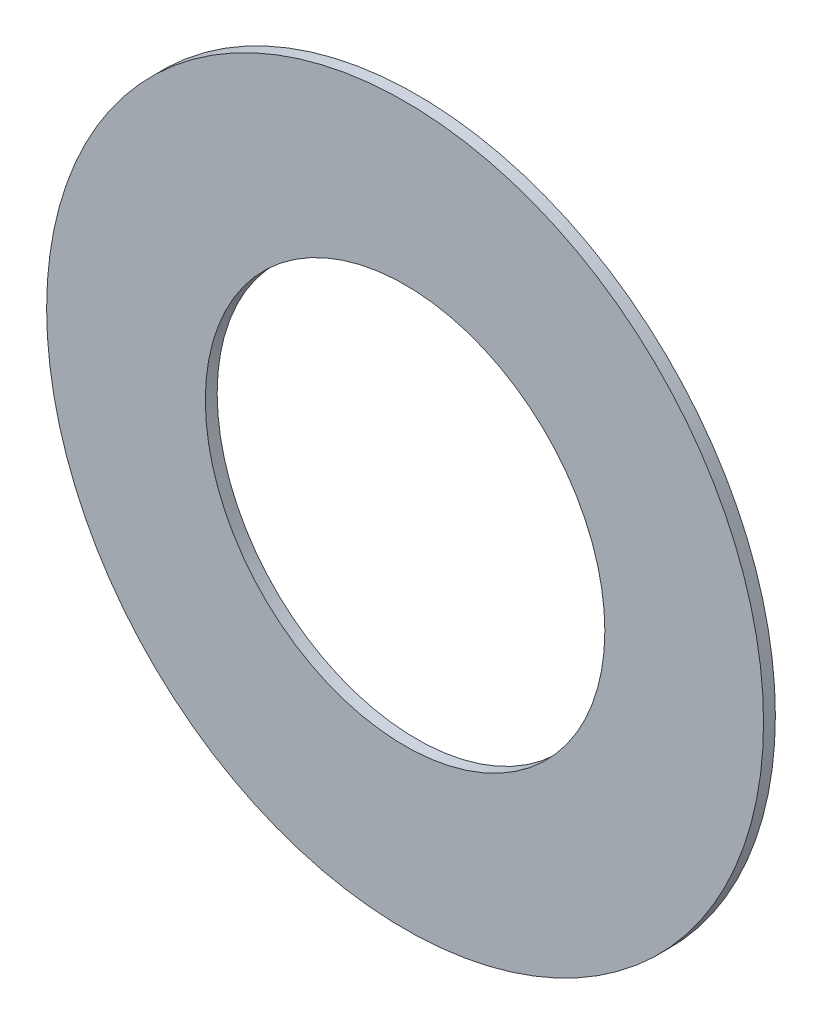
SolidWorks part; units mm, degrees
ref_plane "Front Plane" through (0, 0, 0) normal (1, 0, 0) x (0, 1, 0)
ref_plane "Top Plane" through (0, 0, 0) normal (0, 0, 1) x (0, 1, 0)
ref_plane "Right Plane" through (0, 0, 0) normal (0, 1, 0) x (-1, 0, 0)
sketch "sk 4in Nut" plane through (0, 0, 0) normal (0, 0, 1) x (0, 1, 0)
  point P0 (0, 0)
  line B0 (89.8213, 0) -> (44.9106, 77.7875)
  line B1 (44.9106, 77.7875) -> (-44.9106, 77.7875)
  line B2 (-44.9106, 77.7875) -> (-89.8213, 0)
  line B3 (-89.8213, 0) -> (-44.9106, -77.7875)
  line B4 (-44.9106, -77.7875) -> (44.9106, -77.7875)
  line B5 (44.9106, -77.7875) -> (89.8213, 0)
  circle B6 centre (0, 0) radius 77.7875 construction
  circle B7 centre (0, 0) radius 50.8
sketch_block_instance "4in Nut-1"
sketch_block "4in Nut" parameters "D1"=155.575, "D2"=101.6
sketch "Sketch2" plane through (0, 0, 0) normal (0, 0, 1) x (0, 1, 0)
  circle A0 centre (0, 0) radius 89.8213 construction
  circle A1 centre (0, 0) radius 96.1713
  circle A2 centre (0, 0) radius 53.594
  dimension "D2" = 107.188
  dimension "D1" = 6.35
extrude "Boss-Extrude1" add sketch "Sketch2" along normal mid plane 3.175
